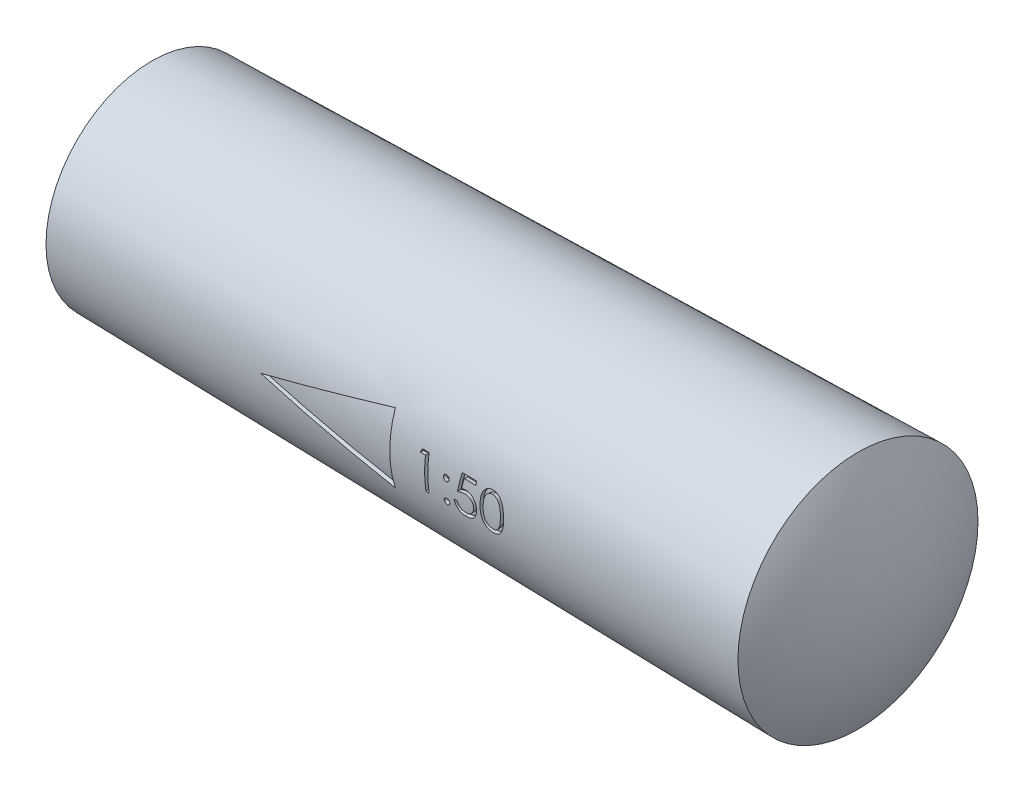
SolidWorks part; units mm, degrees
ref_plane "Front Plane" through (0, 0, 0) normal (0, 0, 1) x (1, 0, 0)
ref_plane "Top Plane" through (0, 0, 0) normal (0, 1, 0) x (1, 0, 0)
ref_plane "Right Plane" through (0, 0, 0) normal (1, 0, 0) x (0, 0, -1)
sketch "Sketch1" plane through (0, 0, 0) normal (1, 0, 0) x (0, 0, -1)
  circle A0 centre (0, 0) radius 3
  dimension "D1" = 6
extrude "Extrude1" add sketch "Sketch1" along normal mid plane 20
draft "Draft1" type of draft neutral plane draft angle 1.146 faces to draft 1 parameters "D1"=1.146
sketch "Sketch2" plane through (0, 0, 0) normal (0, 0, 1) x (1, 0, 0)
  line L0 (-10, 0) -> (-10, 3)
  line L1 (-10, 3) -> (-10, -3) construction
  line L2 (-10, 0) -> (-10.9, 0)
  line L3 (-10.9, 0) -> (-10.9, -3.2) construction
  line L4 (10, 0) -> (10, 3.4)
  line L5 (10, -3.4) -> (10, 3.4) construction
  line L6 (10, 0) -> (10.9, 0)
  line L7 (10.9, 0) -> (10.9, -3.2) construction
  line L8 (-10, -3) -> (10, -3.4) construction
  arc A0 (-10.9, 0) -> (-10, 3) centre (-5.45, 0) cw
  arc A1 (10.9, 0) -> (10, 3.4) centre (4.0277, 0) ccw
  point P14 (0, -3.2)
revolve "Revolve1" add sketch "Sketch2" angle 360 about L2
sketch "Sketch5" plane through (0, 0, 0) normal (0, 0, 1) x (1, 0, 0)
  line L0 (0, 3.2) -> (0, -3.2) construction
  line L1 (10, 3.4) -> (-10, 3) construction
  line L2 (-10, -3) -> (10, -3.4) construction
ref_plane "Plane2" through (0, 0, 0) normal (-0.02, 0, 0.9998) x (0.9998, 0, 0.02)
sketch "Sketch6" plane through (0, 0, 0) normal (-0.02, 0, 0.9998) x (0.9998, 0, 0.02)
  line L0 (0, 0) -> (0, 1)
  line L1 (0, 3.2) -> (0, -3.2) construction
  line L2 (0, 1) -> (-3.7321, 0)
  line L3 (-3.7321, 0) -> (0, -1)
  line L4 (0, -1) -> (0, 0)
  line L5 (0, -0.5) -> (4, -0.5) construction
  text T0 "1:50" font "Century Gothic" height 1
  dimension "D1" = 2
  dimension "D2" = 30
  dimension "D3" = 4
wrap "Wrap2" sketch "Sketch6" wrap type deboss source sketch "Sketch6" thickness 0.1 parameters "D1"=0.1
equation "\"D2@Sketch2\" = \"D1@Sketch2\""
